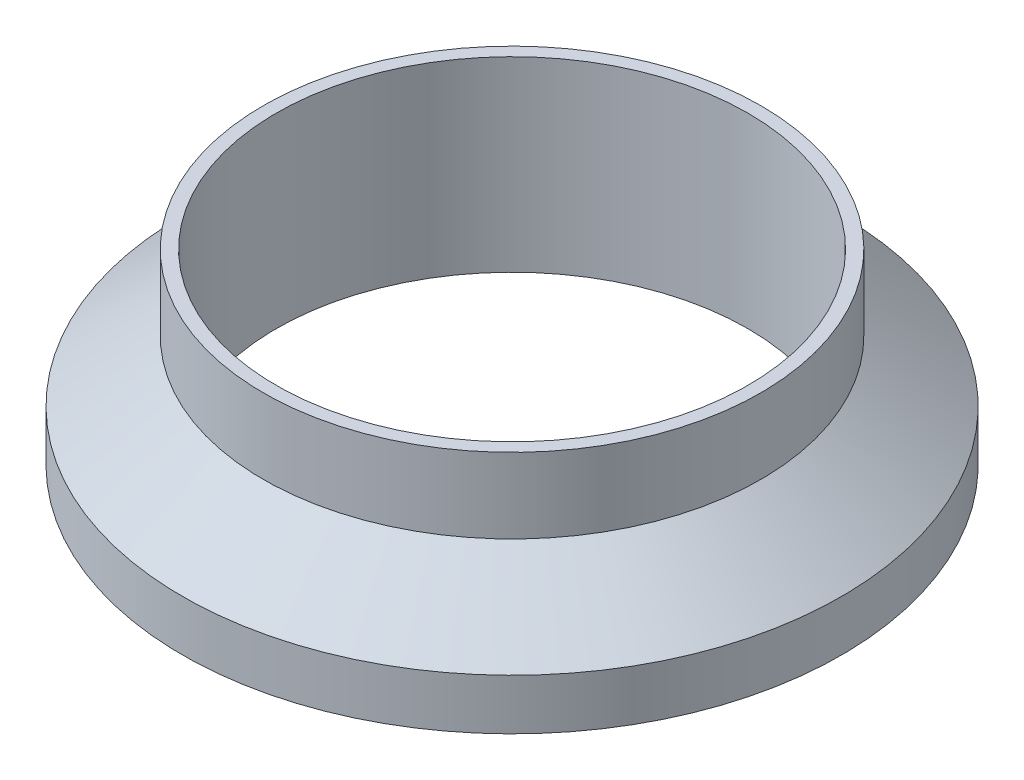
SolidWorks part; units mm, degrees
ref_plane "Front Plane" through (0, 0, 0) normal (0, 0, 1) x (1, 0, 0)
ref_plane "Top Plane" through (0, 0, 0) normal (0, 1, 0) x (1, 0, 0)
ref_plane "Right Plane" through (0, 0, 0) normal (1, 0, 0) x (0, 0, -1)
sketch "Sketch1" plane through (0, 0, 0) normal (0, 0, 1) x (1, 0, 0)
  line L0 (-30.099, 0) -> (-30.099, 23.8252)
  line L1 (-30.099, 23.8252) -> (-31.75, 23.8252)
  line L2 (-31.75, 23.8252) -> (-31.75, 14.248)
  line L3 (-31.75, 14.248) -> (-42.0624, 6.477)
  line L4 (-42.0624, 6.477) -> (-42.0624, 0)
  line L5 (-42.0624, 0) -> (-37.977, 0)
  line L6 (-30.099, 0) -> (-34.921, 0)
  line L7 (0, 0) -> (0, 37.9334) construction
  arc A0 (-34.921, 0) -> (-37.977, 0) centre (-36.449, -0.381) ccw
  dimension "D1" = 3.1496
  dimension "D2" = 30.099
  dimension "D3" = 31.75
  dimension "D4" = 36.449
  dimension "D5" = 42.0624
  dimension "D6" = 6.477
  dimension "D7" = 23.8252
  dimension "D8" = 127
  dimension "D9" = 0.381
revolve "Revolve1" add sketch "Sketch1" angle 360 about L7
